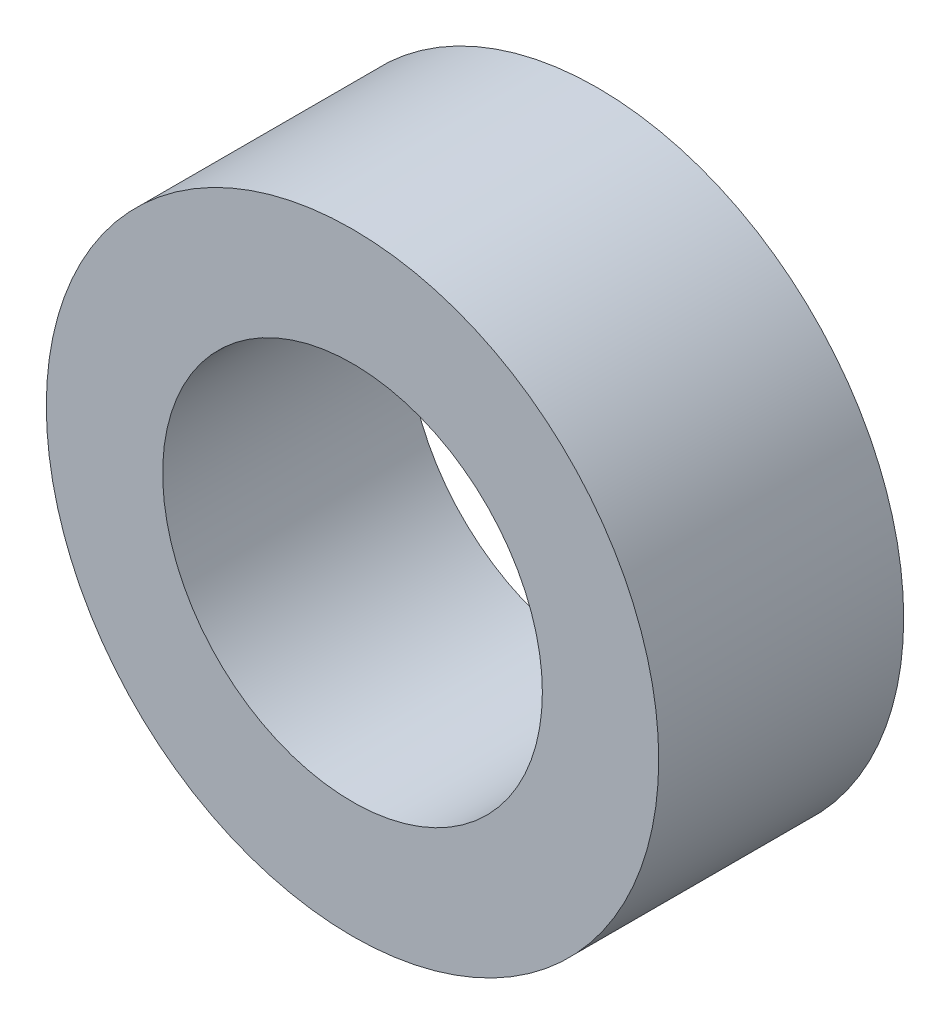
SolidWorks part; units mm, degrees
ref_plane "前视基准面" through (0, 0, 0) normal (0, 0, 1) x (1, 0, 0)
ref_plane "上视基准面" through (0, 0, 0) normal (0, 1, 0) x (1, 0, 0)
ref_plane "右视基准面" through (0, 0, 0) normal (1, 0, 0) x (0, 0, -1)
other "Configuration Table"
sketch "草图1" plane through (0, 0, 0) normal (0, 0, 1) x (1, 0, 0)
  circle A0 centre (0, 0) radius 5
  circle A1 centre (0, 0) radius 3.1
  dimension "D1" = 6.2
  dimension "D2" = 10
extrude "Flanged_Pivot_Bush_Envelope" add sketch "草图1" against normal mid plane 4
